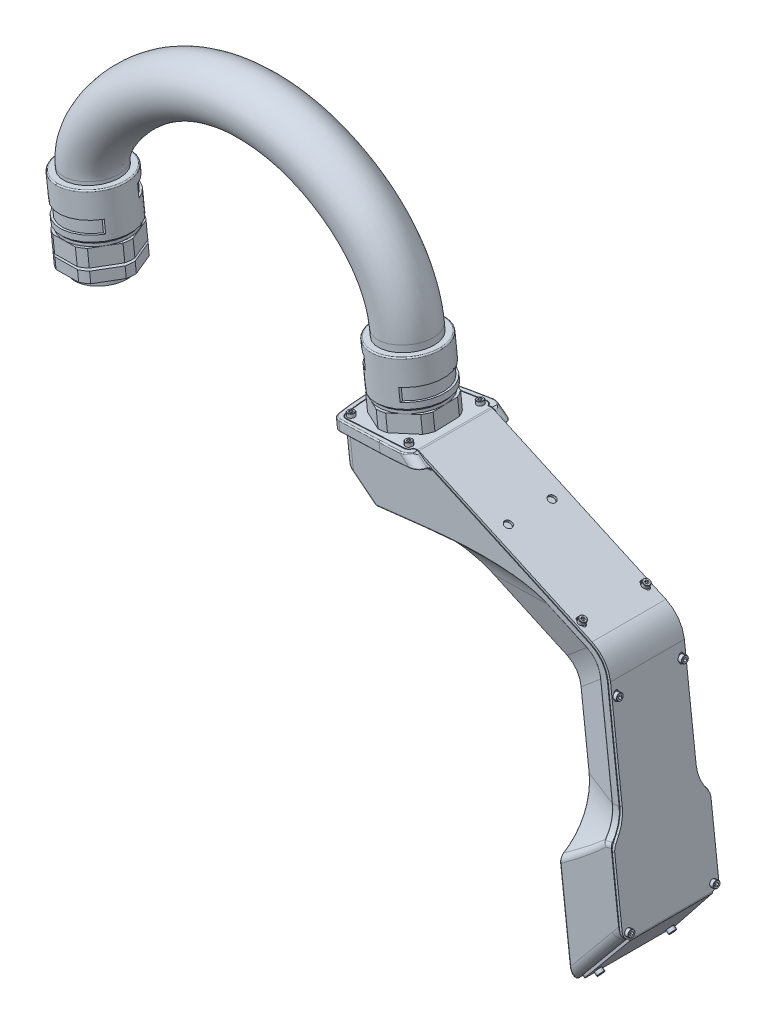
SolidWorks part; units mm, degrees
other "NONE"
ref_plane "前视基准面" through (0, 0, 0) normal (0, 0, 1) x (1, 0, 0)
ref_plane "上视基准面" through (0, 0, 0) normal (0, 1, 0) x (1, 0, 0)
ref_plane "右视基准面" through (0, 0, 0) normal (1, 0, 0) x (0, 0, -1)
imported_body "输入1"
sketch "草图1" plane through (0, 0, 518.0006) normal (0, 0, 1) x (1, 0, 0)
  line L0 (54.3028, 325.6058) -> (120.0417, 333.1279)
  line L1 (54.3028, 325.6058) -> (-69.8754, 339.6371)
  line L2 (-69.8754, 339.6371) -> (-139.3312, 335.1412)
  line L3 (-139.5408, 335.3253) -> (-194.5098, 329.0355)
  arc A0 (-139.3312, 335.1412) -> (-139.5408, 335.3253) centre (-139.344, 335.338) cw
surface "曲面-拉伸1" sketch "草图1" parameters "D1"=117
split "分割1" trimming surface bodies 110 bodies to split 109 resulting bodies 111 112 113 114 115 116
